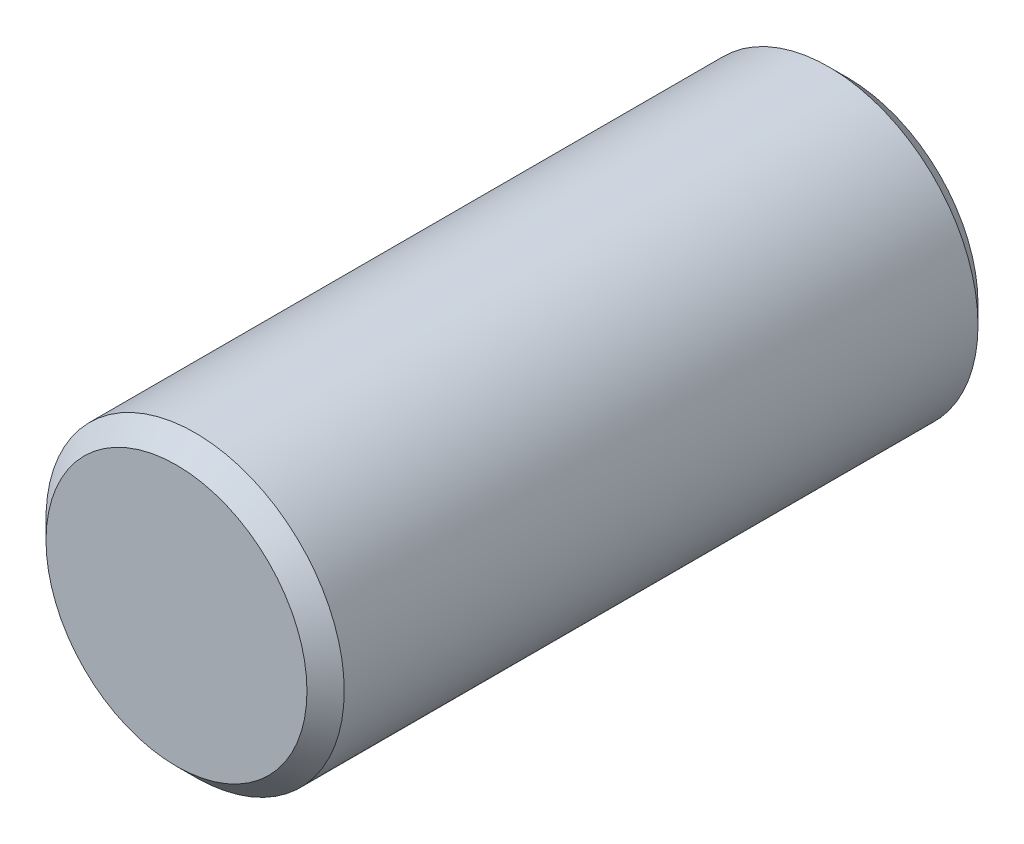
SolidWorks part; units mm, degrees
ref_plane "Plan1" through (0, 0, 0) normal (0, 0, 1) x (1, 0, 0)
ref_plane "Plan2" through (0, 0, 0) normal (0, 1, 0) x (1, 0, 0)
ref_plane "Plan3" through (0, 0, 0) normal (1, 0, 0) x (0, 0, -1)
sketch "Esquisse1" plane through (0, 0, 0) normal (0, 0, 1) x (1, 0, 0)
  circle A0 centre (0, 32) radius 4
  circle A1 centre (0, 32) radius 4 construction
  dimension "D1" = 8
extrude "Base-Extrusion" add sketch "Esquisse1" along normal mid plane 18
chamfer "Chanfrein1" distance 0.5 angle 45
